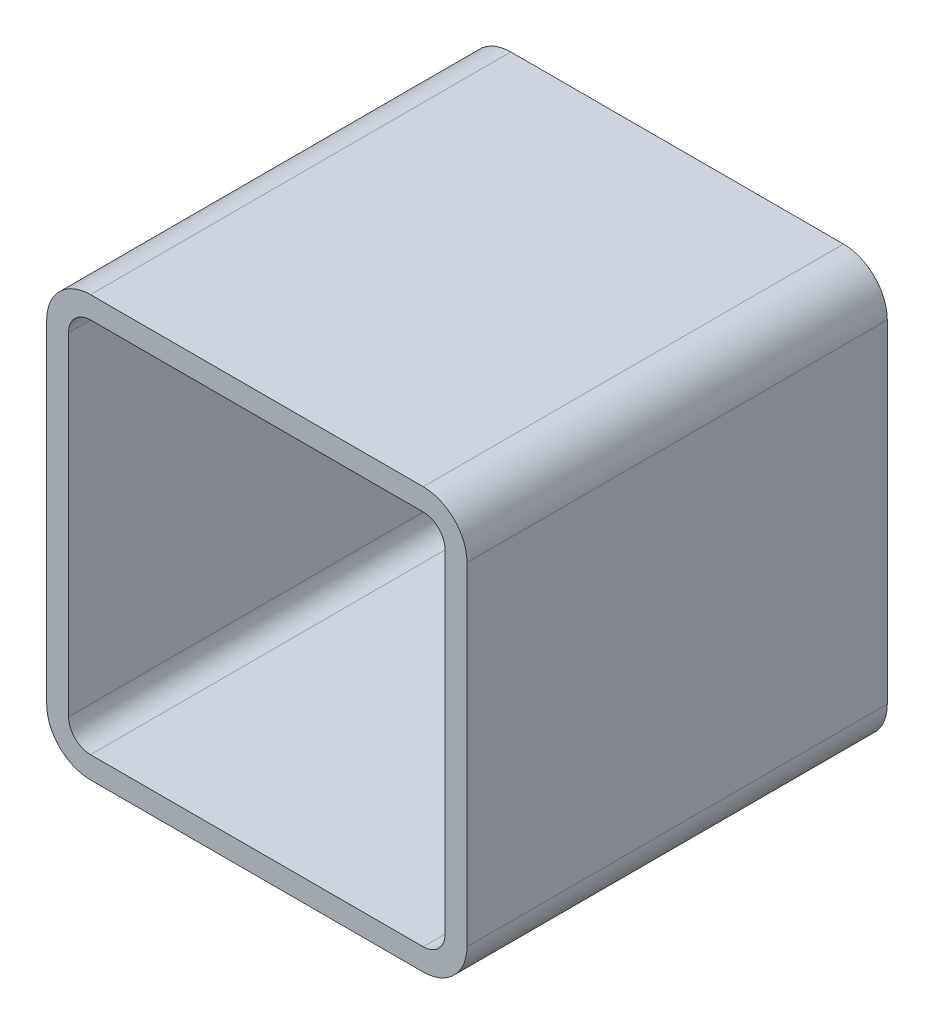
SolidWorks part; units mm, degrees
ref_plane "Front Plane" through (0, 0, 0) normal (0, 0, 1) x (1, 0, 0)
ref_plane "Top Plane" through (0, 0, 0) normal (0, 1, 0) x (1, 0, 0)
ref_plane "Right Plane" through (0, 0, 0) normal (1, 0, 0) x (0, 0, -1)
sketch "Sketch1" plane through (0, 0, 0) normal (0, 0, 1) x (1, 0, 0)
  point P0 (0, 0)
sketch_block_instance "HSS12x12x0.625-1"
sketch_block "HSS12x12x0.625"
extrude "Boss-Extrude1" add sketch "Sketch1" along normal blind 304.8
